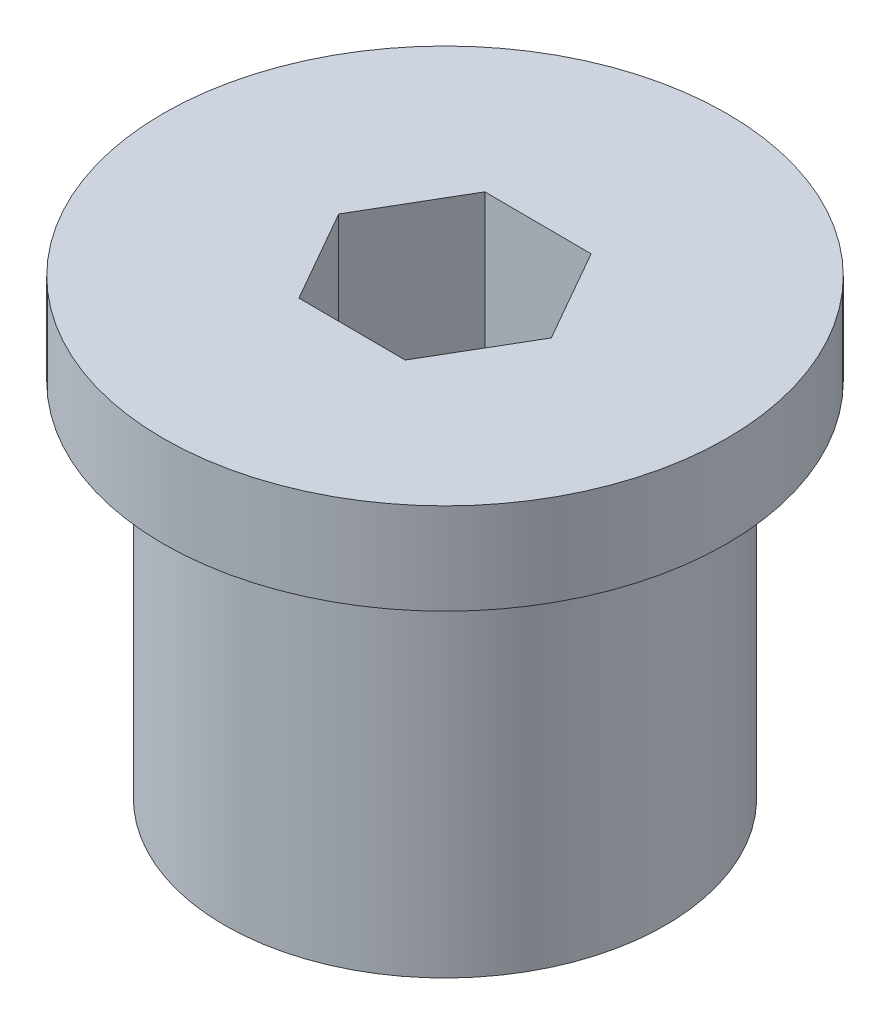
SolidWorks part; units mm, degrees
ref_plane "Front Plane" through (0, 0, 0) normal (0, 0, 1) x (1, 0, 0)
ref_plane "Top Plane" through (0, 0, 0) normal (0, 1, 0) x (1, 0, 0)
ref_plane "Right Plane" through (0, 0, 0) normal (1, 0, 0) x (0, 0, -1)
sketch "Sketch1" plane through (0, 0, 0) normal (0, 0, 1) x (1, 0, 0)
  line L0 (0, 0) -> (0, 73.3572) construction
  line L1 (0, 0) -> (-5.5562, 0)
  line L2 (-5.5562, 0) -> (-5.5562, 9.1)
  line L3 (-5.5562, 9.1) -> (-7.1, 9.1)
  line L4 (-7.1, 9.1) -> (-7.1, 11.4)
  line L5 (-7.1, 11.4) -> (0, 11.4)
  line L6 (0, 11.4) -> (0, 0)
  dimension "D1" = 14.2
  dimension "D2" = 11.1125
  dimension "D3" = 9.1
  dimension "D4" = 11.4
revolve "Revolve1" add sketch "Sketch1" angle 360 about L0
sketch "Sketch2" plane through (0, 11.4, 0) normal (0, 1, 0) x (1, 0, 0)
  line L1 (2.6927, -0.0138) -> (1.3583, 2.325)
  line L2 (1.3583, 2.325) -> (-1.3344, 2.3388)
  line L3 (-1.3344, 2.3388) -> (-2.6927, 0.0138)
  line L4 (-2.6927, 0.0138) -> (-1.3583, -2.325)
  line L5 (-1.3583, -2.325) -> (1.3344, -2.3388)
  line L6 (1.3344, -2.3388) -> (2.6927, -0.0138)
  circle A0 centre (0, 0) radius 2.332 construction
extrude "Extrude1" cut sketch "Sketch2" against normal blind 6
